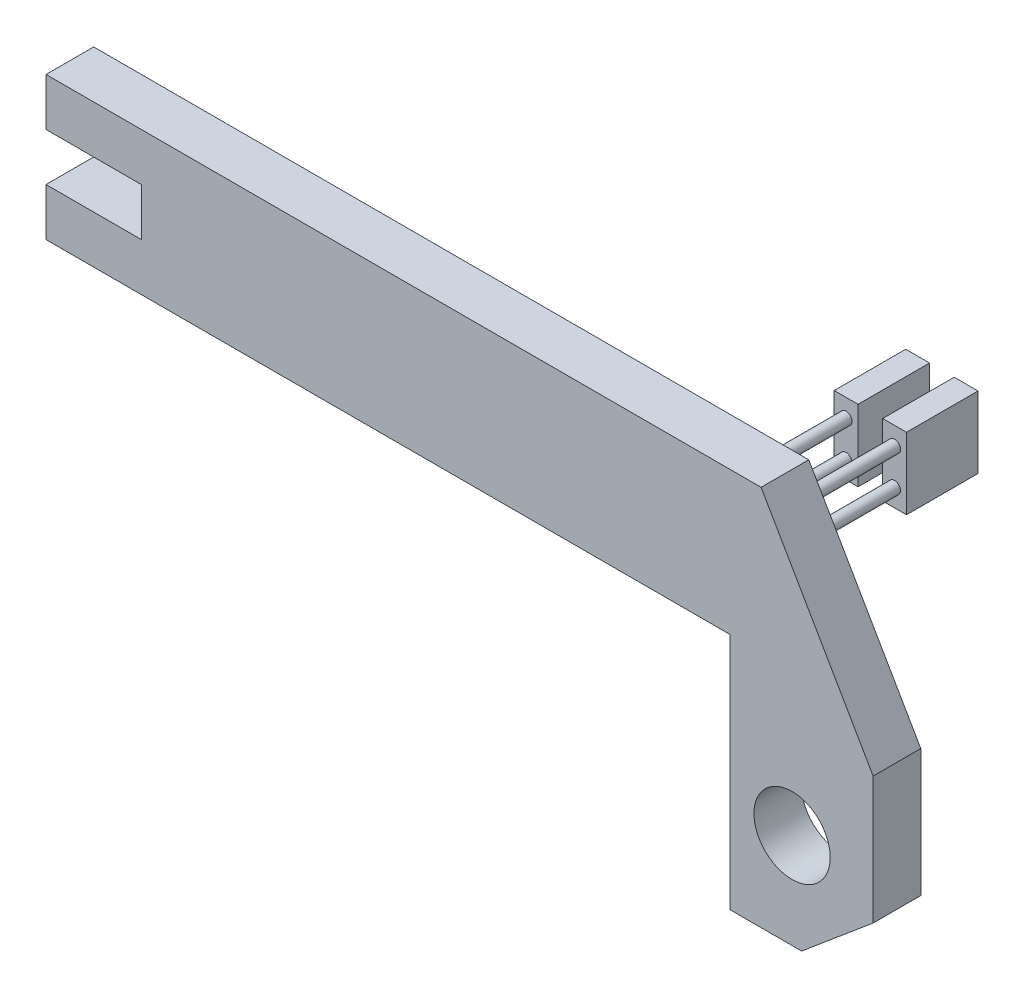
SolidWorks part; units mm, degrees
ref_plane "Plan de face" through (0, 0, 0) normal (0, 0, 1) x (1, 0, 0)
ref_plane "Plan de dessus" through (0, 0, 0) normal (0, 1, 0) x (1, 0, 0)
ref_plane "Plan de droite" through (0, 0, 0) normal (1, 0, 0) x (0, 0, -1)
sketch "Esquisse1" plane through (0, 0, 0) normal (0, 0, 1) x (1, 0, 0)
  line L0 (0, 0) -> (28.7, 0)
  line L1 (28.7, 0) -> (28.7, -10)
  line L2 (28.7, -10) -> (31.7, -10)
  line L3 (31.7, -10) -> (34.7, -7.4827)
  line L4 (34.7, -7.4827) -> (34.7, -2.1406)
  line L5 (34.7, -2.1406) -> (30, 6)
  line L6 (30, 6) -> (0, 6)
  line L7 (0, 6) -> (0, 4)
  line L8 (0, 4) -> (4, 4)
  line L9 (4, 4) -> (4, 2)
  line L10 (4, 2) -> (0, 2)
  line L11 (0, 2) -> (0, 0)
  circle A0 centre (31.3, -6) radius 1.6
  dimension "D12" = 3.2
  dimension "D14" = 4
  dimension "D1" = 2
  dimension "D2" = 2
  dimension "D3" = 2
  dimension "D4" = 4
  dimension "D5" = 30
  dimension "D6" = 28.7
  dimension "D7" = 10
  dimension "D8" = 6
  dimension "D9" = 3
  dimension "D10" = 40
  dimension "D11" = 30
  dimension "D13" = 2.6
extrude "Boss.-Extru.1" add sketch "Esquisse1" along normal blind 2
sketch "Esquisse2" plane through (0, 0, 0) normal (0, 0, -1) x (-1, 0, 0)
  line L0 (0, 0) -> (-28.7, 0) construction
  line L1 (-28.7, 0) -> (-28.7, -10) construction
  circle A0 centre (-28.1, 1.3) radius 0.25
  circle A1 centre (-28.1, 2.8) radius 0.25
  circle A2 centre (-26.0676, 1.3) radius 0.25
  circle A3 centre (-26.0676, 2.8) radius 0.25
  dimension "D1" = 0.5
  dimension "D2" = 0.5
  dimension "D3" = 0.5
  dimension "D4" = 0.5
  dimension "D5" = 1.5
  dimension "D6" = 1.5
  dimension "D7" = 1.3
  dimension "D8" = 1.3
  dimension "D9" = 2.6324
  dimension "D10" = 0.6
extrude "Boss.-Extru.2" add sketch "Esquisse2" along normal blind 5.5
sketch "Esquisse3" plane through (0, 0, -5.5) normal (0, 0, -1) x (-1, 0, 0)
  line L1 (-27.6, 3.55) -> (-28.6, 3.55)
  line L2 (-27.6, 3.55) -> (-27.6, 0.55)
  line L3 (-27.6, 0.55) -> (-28.6, 0.55)
  line L4 (-28.6, 3.55) -> (-28.6, 0.55)
  line L5 (-25.5676, 0.55) -> (-26.5676, 0.55)
  line L6 (-25.5676, 0.55) -> (-25.5676, 3.55)
  line L7 (-25.5676, 3.55) -> (-26.5676, 3.55)
  line L8 (-26.5676, 0.55) -> (-26.5676, 3.55)
  dimension "D1" = 1
  dimension "D2" = 1
  dimension "D3" = 3
  dimension "D4" = 3
  dimension "D5" = 0.5
  dimension "D6" = 0.75
  dimension "D7" = 0.5
extrude "Boss.-Extru.3" add sketch "Esquisse3" along normal blind 3
